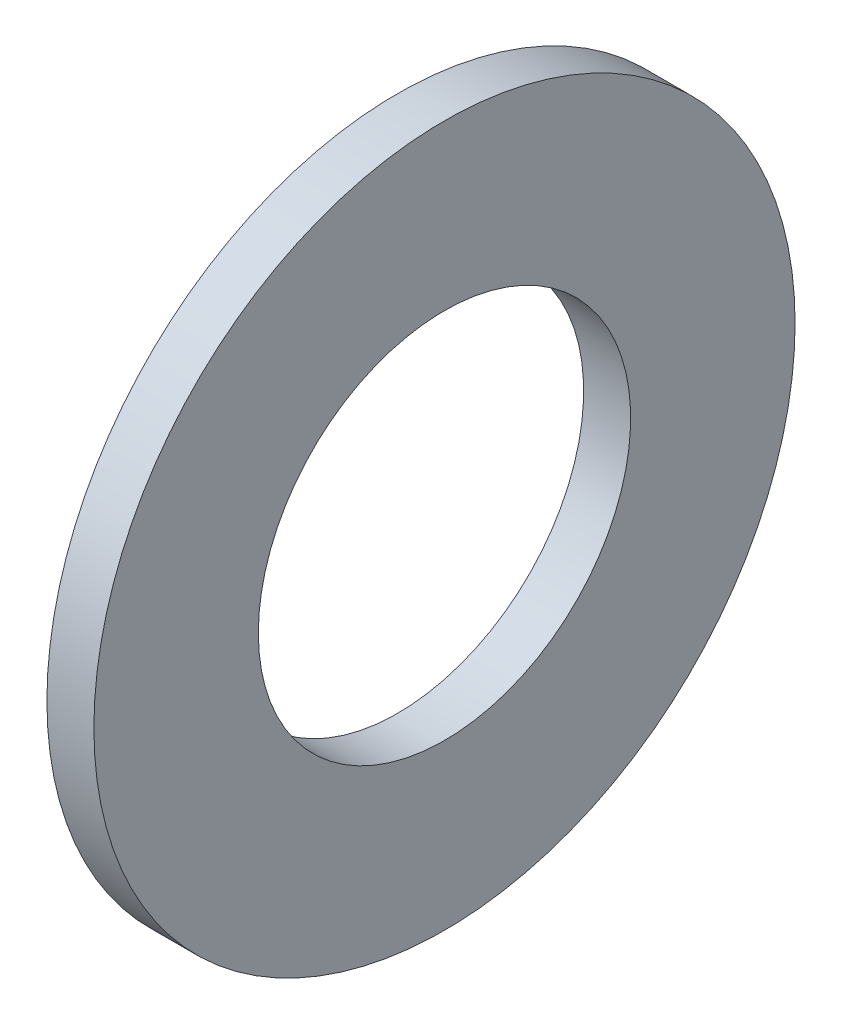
SolidWorks part; units mm, degrees
ref_plane "Plane1" through (0, 0, 0) normal (0, 0, 1) x (1, 0, 0)
ref_plane "Plane2" through (0, 0, 0) normal (0, 1, 0) x (1, 0, 0)
ref_plane "Plane3" through (0, 0, 0) normal (1, 0, 0) x (0, 0, -1)
other "Configuration Table"
sketch "Sketch1" plane through (0, 0, 0) normal (0, 0, 1) x (1, 0, 0)
  line L0 (-34.925, 0) -> (9.525, 0) construction
  line L1 (0, 13.4874) -> (0, 25.4)
  line L2 (0, 25.4) -> (-3.4036, 25.4)
  line L3 (-3.4036, 25.4) -> (-3.4036, 13.4874)
  line L4 (-3.4036, 13.4874) -> (0, 13.4874)
  dimension "Thickness" = 3.4036
  dimension "Inside_dia" = 26.9748
  dimension "Outside_dia" = 50.8
revolve "Base-Revolve" add sketch "Sketch1" angle 360 about L0
